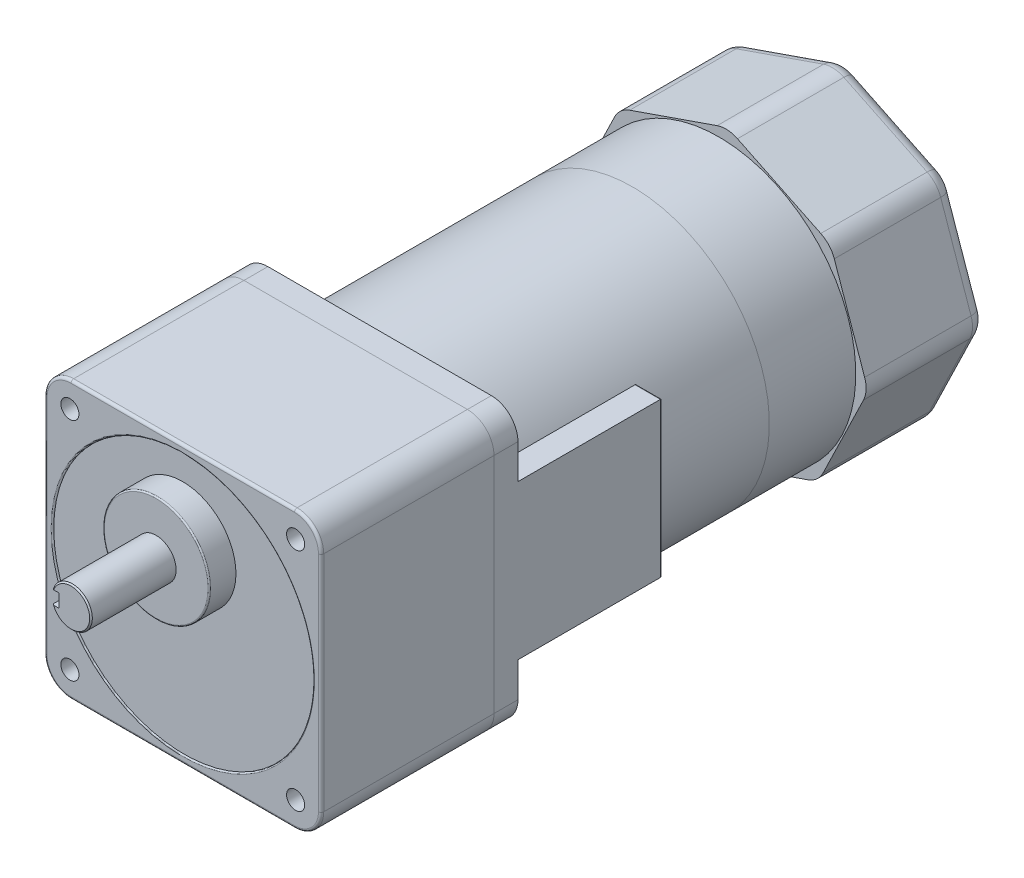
SolidWorks part; units mm, degrees
ref_plane "前视基准面" through (0, 0, 0) normal (0, 0, 1) x (1, 0, 0)
ref_plane "上视基准面" through (0, 0, 0) normal (0, 1, 0) x (1, 0, 0)
ref_plane "右视基准面" through (0, 0, 0) normal (1, 0, 0) x (0, 0, -1)
sketch "草图1" plane through (0, 0, 0) normal (0, 0, 1) x (1, 0, 0)
  line L1 (-42, -52) -> (42, -52)
  line L2 (-52, -42) -> (-52, 42)
  line L3 (-42, 52) -> (42, 52)
  line L4 (52, -42) -> (52, 42)
  line L5 (-52, -52) -> (52, 52) construction
  line L6 (-52, 52) -> (52, -52) construction
  arc A0 (-42, -52) -> (-52, -42) centre (-42, -42) cw
  arc A1 (-52, 42) -> (-42, 52) centre (-42, 42) cw
  arc A2 (42, 52) -> (52, 42) centre (42, 42) cw
  arc A3 (42, -52) -> (52, -42) centre (42, -42) ccw
  point P0 (0, 0)
  dimension "D1" = 10
extrude "凸台-拉伸1" add sketch "草图1" along normal blind 65
sketch "草图2" plane through (0, 0, 0) normal (0, 0, -1) x (-1, 0, 0)
  line L0 (52, 42) -> (52, -42) construction
  line L1 (-42, 52) -> (42, 52)
  line L2 (-52, 42) -> (-52, -42)
  line L3 (-42, -52) -> (42, -52)
  line L4 (52, 42) -> (52, -42)
  line L5 (-52, 52) -> (52, -52) construction
  line L6 (-52, -52) -> (52, 52) construction
  arc A0 (42, -52) -> (52, -42) centre (42, -42) ccw
  arc A1 (-52, -42) -> (-42, -52) centre (-42, -42) ccw
  arc A2 (-42, 52) -> (-52, 42) centre (-42, 42) ccw
  arc A3 (42, 52) -> (52, 42) centre (42, 42) cw
  point P0 (0, 0)
  dimension "D1" = 10
extrude "凸台-拉伸2" add sketch "草图2" along normal blind 9 separate body
sketch "草图3" plane through (0, 0, -9) normal (0, 0, -1) x (-1, 0, 0)
  line L0 (-52, 42) -> (-52, -42) construction
  line L1 (0, 29) -> (-52, 29)
  line L3 (0, -29) -> (-52, -29)
  line L4 (-52, 29) -> (-52, -29)
  line L8 (0, 29) -> (0, -29)
  point P0 (0, 0)
extrude "凸台-拉伸3" add sketch "草图3" along normal blind 54
sketch "草图4" plane through (0, 0, -9) normal (0, 0, -1) x (-1, 0, 0)
  circle A0 centre (0, 0) radius 51.5
extrude "凸台-拉伸4" add sketch "草图4" along normal blind 95 separate body
sketch "草图5" plane through (0, 0, -104) normal (0, 0, -1) x (-1, 0, 0)
  circle A0 centre (0, 0) radius 51.5
extrude "凸台-拉伸5" add sketch "草图5" along normal blind 32.5 separate body
sketch "草图6" plane through (0, 0, -136.5) normal (0, 0, -1) x (-1, 0, 0)
  line L1 (-7.0224, 54.3814) -> (-38.3332, 39.2074)
  line L2 (-43.419, 33.4879) -> (-54.8295, 0.6182)
  line L3 (-54.3814, -7.0224) -> (-39.2074, -38.3332)
  line L4 (-33.4879, -43.419) -> (-0.6182, -54.8295)
  line L5 (7.0224, -54.3814) -> (38.3332, -39.2074)
  line L6 (43.419, -33.4879) -> (54.8295, -0.6182)
  line L7 (54.3814, 7.0224) -> (39.2074, 38.3332)
  line L8 (33.4879, 43.419) -> (0.6182, 54.8295)
  circle A0 centre (0, 0) radius 52 construction
  arc A1 (-54.8295, 0.6182) -> (-54.3814, -7.0224) centre (-45.3825, -2.6612) ccw
  arc A2 (-39.2074, -38.3332) -> (-33.4879, -43.419) centre (-30.2085, -33.9721) ccw
  arc A3 (-0.6182, -54.8295) -> (7.0224, -54.3814) centre (2.6612, -45.3825) ccw
  arc A4 (38.3332, -39.2074) -> (43.419, -33.4879) centre (33.9721, -30.2085) ccw
  arc A5 (54.8295, -0.6182) -> (54.3814, 7.0224) centre (45.3825, 2.6612) ccw
  arc A6 (39.2074, 38.3332) -> (33.4879, 43.419) centre (30.2085, 33.9721) ccw
  arc A7 (-7.0224, 54.3814) -> (0.6182, 54.8295) centre (-2.6612, 45.3825) cw
  arc A8 (-38.3332, 39.2074) -> (-43.419, 33.4879) centre (-33.9721, 30.2085) ccw
  dimension "D1" = 10
extrude "凸台-拉伸6" add sketch "草图6" along normal blind 45 separate body
fillet "圆角1" radius 5 16 edges at (49.1243, 17.0531, -181.5) (41.4449, 36.8535, -181.5) (22.6778, 46.7944, -181.5) (3.2466, 55.3654, -181.5) (-17.0531, 49.1243, -181.5) (-36.8535, 41.4449, -181.5) (-46.7944, 22.6778, -181.5) (-55.3654, 3.2466, -181.5) (-49.1243, -17.0531, -181.5) (-41.4449, -36.8535, -181.5) (-22.6778, -46.7944, -181.5) (-3.2466, -55.3654, -181.5) (17.0531, -49.1243, -181.5) (36.8535, -41.4449, -181.5) (46.7944, -22.6778, -181.5) (55.3654, -3.2466, -181.5)
fillet "圆角2" radius 1 8 edges at (-52, 0, 65) (-49.0711, 49.0711, 65) (0, 52, 65) (49.0711, 49.0711, 65) (52, 0, 65) (49.0711, -49.0711, 65) (0, -52, 65) (-49.0711, -49.0711, 65)
fillet "圆角3" radius 0.5 3 edges at (26, -29, -63) (26, 29, -63) (52, 0, -63)
sketch "草图7" plane through (0, 0, 65) normal (0, 0, 1) x (1, 0, 0)
  point P19 (-42.4264, 42.4264)
  point P20 (-42.4264, -42.4264)
  point P21 (42.4264, -42.4264)
  point P22 (42.4264, 42.4264)
sketch "草图9" plane through (0, 0, -9) normal (0, 0, -1) x (-1, 0, 0)
  circle A5 centre (-42.4264, -42.4264) radius 4.5
  circle A6 centre (42.4264, -42.4264) radius 4.5
  circle A7 centre (-42.4264, 42.4264) radius 4.5
  circle A8 centre (42.4264, 42.4264) radius 4.5
extrude "切除-拉伸1" cut sketch "草图9" against normal blind 28.75
hole_wizard "M8 螺纹孔2" positions "3D草图4" profile "草图11" tap size "M8" standard "GB"
sketch3d "3D草图4"
  point P0 (-42.4264, 42.4264, 65)
  point P3 (42.4264, 42.4264, 65)
  point P6 (42.4264, -42.4264, 65)
  point P9 (-42.4264, -42.4264, 65)
sketch "草图11" plane through (-42.4264, 42.4264, 65) normal (1, 0, 0) x (0, -1, 0)
  line L0 (0, 0) -> (0, 24.2929)
  line L1 (0, 24.2929) -> (3.4, 22.25)
  line L2 (3.4, 22.25) -> (3.4, 0)
  line L5 (3.4, 0) -> (0, 0)
  line L10 (0, 24.2929) -> (-3.4, 22.25) construction
  line L11 (0, -6.35) -> (0, 107.95) construction
  dimension "螺纹孔钻头直径" = 6.8
  dimension "螺纹孔钻头深度" = 22.25
  dimension "导头角度" = 118
sketch "草图12" plane through (0, 0, 65) normal (0, 0, 1) x (1, 0, 0)
  circle A0 centre (0, 20) radius 20
extrude "凸台-拉伸7" add sketch "草图12" along normal blind 10 separate body
fillet "圆角4" radius 0.5 1 edges at (20, 20, 75)
sketch "草图13" plane through (0, 0, 75) normal (0, 0, 1) x (1, 0, 0)
  circle A0 centre (0, 20) radius 7.5
extrude "凸台-拉伸8" add sketch "草图13" along normal blind 32 separate body
ref_plane "基准面1" through (-7.5, 0, 0) normal (1, 0, 0) x (0, 0, -1)
chamfer "倒角2" distance 0.5 angle 45 1 edges at (7.5, 20, 107)
sketch "草图16" plane through (0, 0, 65) normal (0, 0, 1) x (1, 0, 0)
  circle A0 centre (0, 0) radius 49
extrude "切除-拉伸3" cut sketch "草图16" against normal blind 0.5
fillet "圆角5" radius 0.5 1 edges at (49, 0, 65)
sketch "草图18" plane through (-7.5, 0, 0) normal (1, 0, 0) x (0, 0, -1)
  line L1 (-107, 27) -> (-107, 13) construction
  line L2 (-84.5, 22.5) -> (-107, 22.5)
  line L3 (-107, 22.5) -> (-107, 17.5)
  line L4 (-107, 17.5) -> (-84.5, 17.5)
  arc A0 (-84.5, 17.5) -> (-84.5, 22.5) centre (-84.5, 20) ccw
extrude "切除-拉伸4" cut sketch "草图18" along normal blind 3
